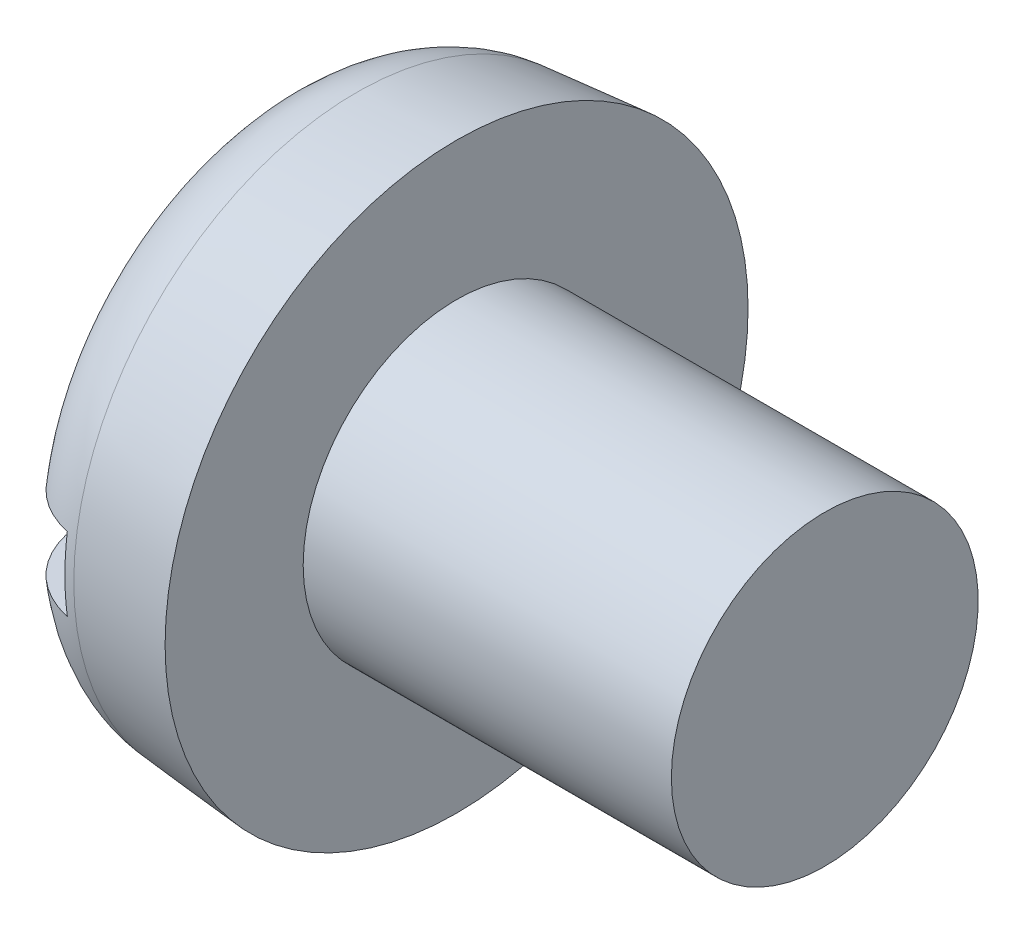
SolidWorks part; units mm, degrees
ref_plane "Plane1" through (0, 0, 0) normal (0, 0, 1) x (1, 0, 0)
ref_plane "Plane2" through (0, 0, 0) normal (0, 1, 0) x (1, 0, 0)
ref_plane "Plane3" through (0, 0, 0) normal (1, 0, 0) x (0, 0, -1)
sketch "BodySke" plane through (0, 0, 0) normal (0, 0, 1) x (1, 0, 0)
  line L0 (3, 2.5) -> (3, 4.75)
  line L1 (0, 0) -> (0, 4.4875)
  line L2 (-25.4, 0) -> (127, 0) construction
  line L3 (9, 0) -> (0, 0)
  line L4 (3, 2.5) -> (9, 2.5)
  line L5 (9, 2.5) -> (9, 0)
  line L6 (0, 4.4875) -> (3, 4.75)
  line L9 (3.8, 4.0875) -> (3.8, -5.4375) construction
  line L10 (3, 6.35) -> (3, -3.175) construction
  dimension "Head_ht" = 3
  dimension "Diameter" = 5
  dimension "Length" = 6
  dimension "Head_dia" = 9.5
  dimension "Advance" = 0.8
  dimension "Thread_nom" = 6
  dimension "Head_side_angle" = 5
revolve "Base-Revolve" add sketch "BodySke"
fillet "Fillet1" [suppressed] radius 0.2
fillet "Fillet2" radius 1.5 1 edges at (0, 0, 4.4875)
sketch "Sketch2" plane through (0, 0, 0) normal (1, 0, 0) x (0, 0, -1)
  line L0 (4.75, -0.6) -> (-4.75, -0.6)
  line L1 (4.75, -0.6) -> (4.75, 0.6)
  line L2 (-4.75, 0.6) -> (4.75, 0.6)
  line L3 (-4.75, 0.6) -> (-4.75, -0.6)
  dimension "D1" = 9.5
  dimension "D2" = 4.75
  dimension "Slot_width" = 1.2
  dimension "D3" = 0.6
extrude "Slot" cut sketch "Sketch2" along normal blind 1.2
sketch "ThdSchSke" plane through (0, 0, 0) normal (0, 0, 1) x (1, 0, 0)
  line L0 (4.6, -2.055) -> (4.2884, -2.5)
  line L1 (4.6, -2.055) -> (4.9116, -2.5)
  line L2 (4.9116, -2.5) -> (4.9116, -3.125)
  line L3 (-3.175, 0) -> (5.1513, 0) construction
  line L5 (4.9116, -3.125) -> (4.2884, -3.125)
  line L6 (4.2884, -3.125) -> (4.2884, -2.5)
  dimension "Thread_minor" = 4.11
  dimension "Diameter" = 5
  dimension "Start" = 4.6
  dimension "SideAngle" = 55
  dimension "VeeAngle" = 70
  dimension "Overcut" = 6.25
revolve "ThreadSchematic" [suppressed] cut sketch "ThdSchSke" angle 360 about L3
pattern_linear "ThdSchPat" [suppressed]
equation "\"D1@Sketch2\" = \"Head_dia@BodySke\""
equation "\"D2@Sketch2\" = \"D1@Sketch2\" / 2"
equation "\"D3@Sketch2\" = \"Slot_width@Sketch2\" / 2"
equation "\"Thread_length@ThreadCosmetic\" = ((sgn( (\"Length@BodySke\" - \"Advance@BodySke\" * 2.0 ) - \"Thread_nom@BodySke\" )-1)*( (\"Length@BodySke\" - \"Advance@BodySke\"  * 2.0) - \"Thread_nom@BodySke\" ))/-2+ \"Thread_"
equation "\"Thread_minor@ThdSchSke\" = \"Thread_minor@ThreadCosmetic\""
equation "\"Diameter@ThdSchSke\" = \"Diameter@BodySke\""
equation "\"Overcut@ThdSchSke\" = \"Diameter@BodySke\" * 1.25"
equation "\"Start@ThdSchSke\" = \"Head_ht@BodySke\" + \"Length@BodySke\" - \"Thread_length@ThreadCosmetic\"  '---Non-countersunk---"
equation "\"Num_threads@ThdSchPat\" = int( \"Thread_length@ThreadCosmetic\" / \"Advance@BodySke\" + 0.999 )  + 1"
equation "\"Advance@ThdSchPat\" = \"Thread_length@ThreadCosmetic\" /  (\"Num_threads@ThdSchPat\" - 1) 'relax it"
